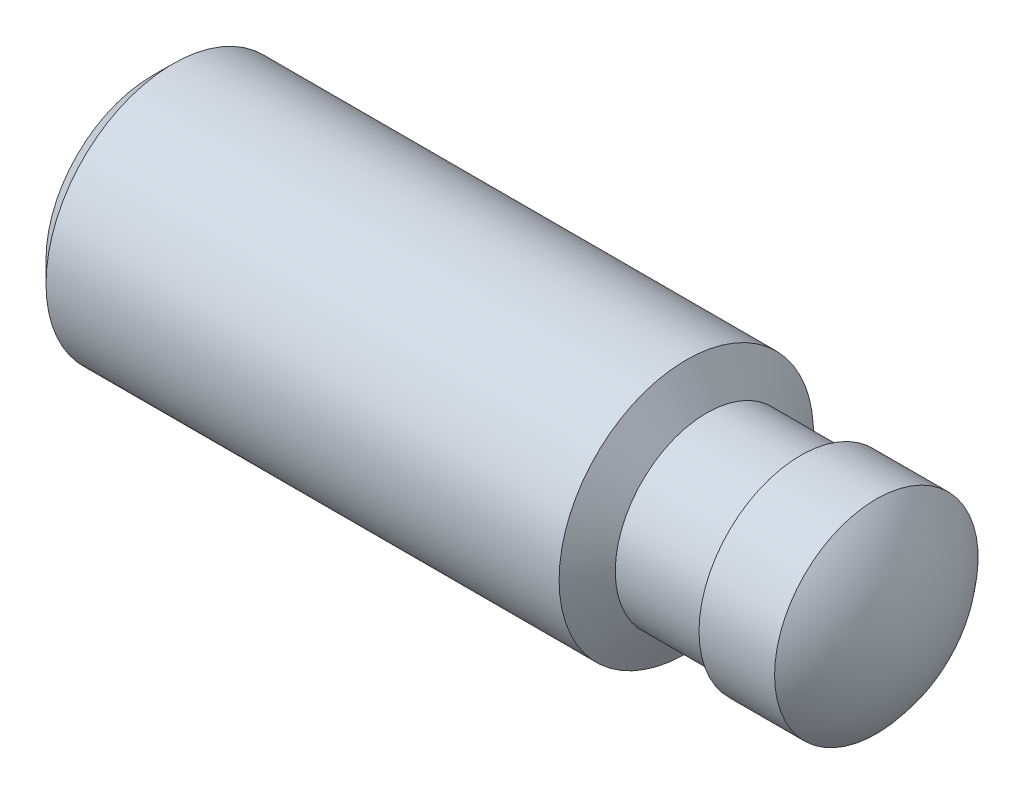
SolidWorks part; units mm, degrees
ref_plane "Plane1" through (0, 0, 0) normal (0, 0, 1) x (1, 0, 0)
ref_plane "Plane2" through (0, 0, 0) normal (0, 1, 0) x (1, 0, 0)
ref_plane "Plane3" through (0, 0, 0) normal (1, 0, 0) x (0, 0, -1)
sketch "BodySke" plane through (0, 0, 0) normal (0, 0, 1) x (1, 0, 0)
  line L0 (0.828, -5) -> (19.05, -5) construction
  line L1 (21.8083, 3.6) -> (25.5, 3.6)
  line L2 (0.828, 5) -> (21, 5)
  line L3 (21.8083, 3.6) -> (21, 5)
  line L5 (-3.175, 0) -> (33.7104, 0) construction
  line L6 (1.5, 12.7) -> (1.5, -6.35) construction
  line L7 (25.5, 3.6) -> (25.5, 4)
  line L8 (21.8083, -3.6) -> (25.5, -3.6) construction
  line L9 (0, 0) -> (0, 4.172)
  line L10 (0, 4.172) -> (0.828, 5)
  line L11 (25.5, 4) -> (28.4721, 4)
  line L12 (30, 0) -> (0, 0)
  arc A0 (28.4721, 4) -> (30, 0) centre (24, 0) cw
  dimension "D1" = 60
  dimension "oval_rad" = 6
  dimension "Length" = 30
  dimension "Diameter" = 10
  dimension "Drive_ch_ang" = 45
  dimension "Dog_dia" = 8
  dimension "Advance" = 1.5
  dimension "Minor_dia" = 8.344
  dimension "Neck_dia" = 7.2
  dimension "Thrust_len" = 4.5
  dimension "pt_len" = 9
revolve "BaseBody" add sketch "BodySke" angle 360 about L5
sketch "ThdSchSke" plane through (0, 0, 0) normal (0, 0, 1) x (1, 0, 0)
  line L0 (0.828, -4.172) -> (0.2482, -5)
  line L1 (0.828, -4.172) -> (1.4078, -5)
  line L2 (1.4078, -5) -> (1.4078, -6.25)
  line L3 (-3.175, 0) -> (5.1513, 0) construction
  line L5 (1.4078, -6.25) -> (0.2482, -6.25)
  line L6 (0.2482, -6.25) -> (0.2482, -5)
  line L7 (0.828, -5) -> (0.828, 5) construction
  dimension "Thread_minor" = 8.344
  dimension "Diameter" = 10
  dimension "SideAngle" = 55
  dimension "VeeAngle" = 70
  dimension "Overcut" = 12.5
revolve "ThreadSchematic" [suppressed] cut sketch "ThdSchSke" angle 360 about L3
pattern_linear "ThdSchPat" [suppressed]
equation "\"Thread_minor@ThreadCosmetic\" = \"Minor_dia@BodySke\""
equation "\"Thread_minor@ThdSchSke\" = \"Thread_minor@ThreadCosmetic\""
equation "\"Diameter@ThdSchSke\" = \"Diameter@BodySke\""
equation "\"Overcut@ThdSchSke\" = \"Diameter@BodySke\" * 1.25"
equation "\"Num_threads@ThdSchPat\" = int( (\"Length@BodySke\" - ( ( ( \"Diameter@BodySke\" - \"Minor_dia@BodySke\" ) * 0.5 ) / tan( \"Drive_ch_ang@BodySke\" * 0.017453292 ) ) - \"pt_len@BodySke\" ) / \"Advance@BodySke\" + 0"
equation "\"Advance@ThdSchPat\" = (\"Length@BodySke\" - ( ( ( \"Diameter@BodySke\" - \"Minor_dia@BodySke\" ) * 0.5 ) / tan( \"Drive_ch_ang@BodySke\" * 0.017453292 ) ) - \"pt_len@BodySke\" ) /  (\"Num_threads@ThdSchPat\" - 1)"
equation "'  \"Num_threads@ThdSchPat\" = \"Num_threads@ThdSchPat\" - sgn( \"Num_threads@ThdSchPat\" - 1) '---chamfered tips only---"
